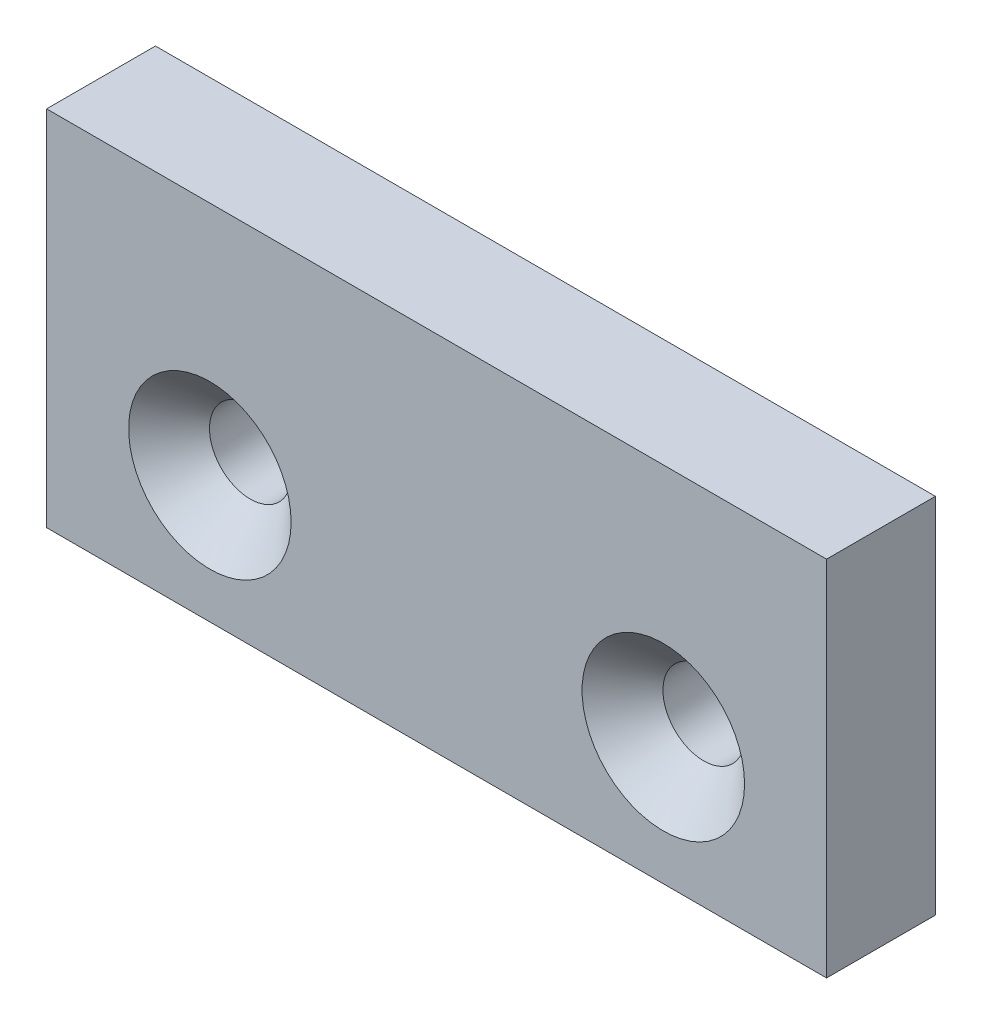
SolidWorks part; units mm, degrees
ref_plane "Plan de face" through (0, 0, 0) normal (0, 0, 1) x (1, 0, 0)
ref_plane "Plan de dessus" through (0, 0, 0) normal (0, 1, 0) x (1, 0, 0)
ref_plane "Plan de droite" through (0, 0, 0) normal (1, 0, 0) x (0, 0, -1)
sketch "Esquisse1" plane through (0, 0, 0) normal (0, 0, 1) x (1, 0, 0)
  line L1 (0, 0) -> (43, 0)
  line L2 (0, 0) -> (0, -20)
  line L3 (0, -20) -> (43, -20)
  line L4 (43, 0) -> (43, -20)
  dimension "D1" = 43
  dimension "D2" = 20
extrude "Extrusion1" add sketch "Esquisse1" along normal blind 6
hole_wizard "Fraisage pour vis à tête fraisée à 6 pans creux M41" positions "Esquisse3" profile "Esquisse2" countersink size "M4" standard "ISO"
sketch "Esquisse3" plane through (0, 0, 6) normal (0, 0, 1) x (1, 0, 0)
  line L0 (43, -6) -> (0, -6) construction
  line L1 (43, -20) -> (43, 0) construction
  line L2 (0, 0) -> (0, -20) construction
  line L3 (43, 0) -> (0, 0) construction
  line L4 (9, -13) -> (34, -13) construction
  line L5 (21.5, -6) -> (21.5, -13) construction
  point P0 (9, -13)
  point P14 (34, -13)
  dimension "D1" = 6
  dimension "D2" = 25
  dimension "D3" = 7
sketch "Esquisse2" plane through (9, -13, 6) normal (1, 0, 0) x (0, -1, 0)
  line L0 (0, 0) -> (0, 6)
  line L1 (0, 6) -> (2.25, 6)
  line L2 (2.25, 6) -> (2.25, 2.23)
  line L3 (2.25, 2.23) -> (4.48, 0)
  line L5 (4.48, 0) -> (0, 0)
  line L6 (-2.25, 2.23) -> (-4.48, 0) construction
  line L11 (0, -6.35) -> (0, 107.95) construction
  dimension "Diamètre du perçage jusqu'au prochain" = 4.5
  dimension "Profondeur du perçage jusqu'au prochain" = 6
  dimension "Diamètre du fraisage entrant" = 8.96
  dimension "Angle du fraisage entrant" = 90
